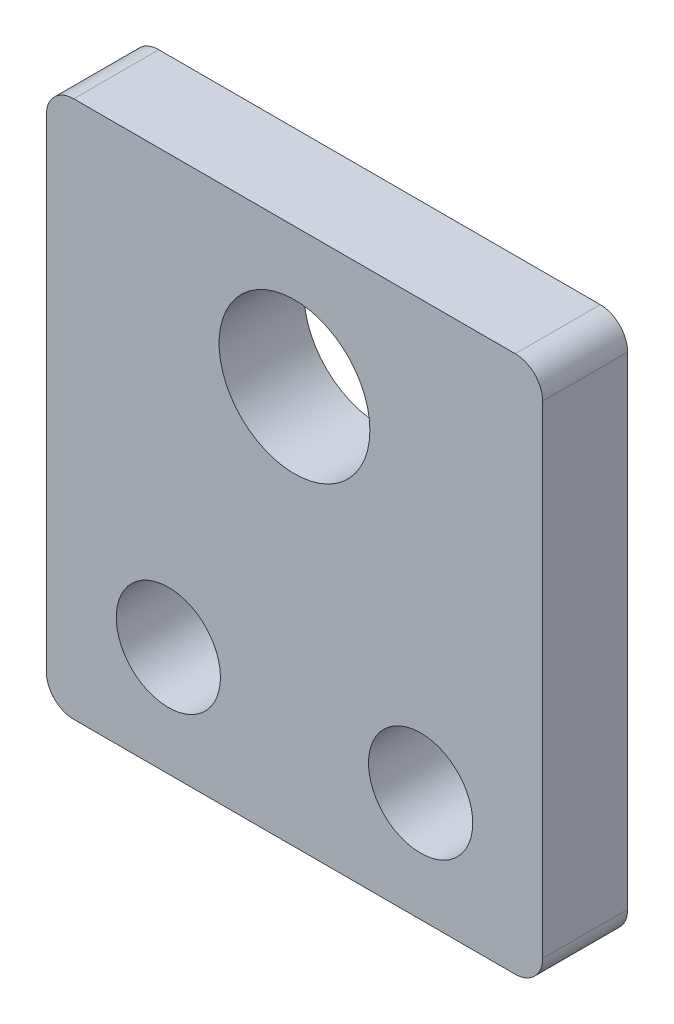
SolidWorks part; units mm, degrees
ref_plane "Front Plane" through (0, 0, 0) normal (0, 0, 1) x (1, 0, 0)
ref_plane "Top Plane" through (0, 0, 0) normal (0, 1, 0) x (1, 0, 0)
ref_plane "Right Plane" through (0, 0, 0) normal (1, 0, 0) x (0, 0, -1)
sketch "Sketch1" plane through (0, 0, 0) normal (0, 0, 1) x (1, 0, 0)
  line L1 (0, 0) -> (45.974, 0)
  line L2 (0, 0) -> (0, 49.784)
  line L3 (0, 49.784) -> (45.974, 49.784)
  line L4 (45.974, 0) -> (45.974, 49.784)
  dimension "D1" = 45.974
  dimension "D2" = 49.784
extrude "Boss-Extrude1" add sketch "Sketch1" along normal blind 7.874
sketch "Sketch2" plane through (0, 0, 7.874) normal (0, 0, 1) x (1, 0, 0)
  line L0 (0, 0) -> (11.303, 0) construction
  line L1 (0, 0) -> (45.974, 0) construction
  line L2 (11.303, 0) -> (11.303, 10.16) construction
  line L3 (45.974, 0) -> (34.671, 0) construction
  line L4 (34.671, 0) -> (34.671, 10.16) construction
  line L5 (22.987, 0) -> (22.987, 36.9062) construction
  circle A0 centre (34.671, 10.16) radius 4.826
  circle A1 centre (11.303, 10.16) radius 4.826
  circle A2 centre (22.987, 36.9062) radius 6.985
  dimension "D6" = 13.97
  dimension "D7" = 9.652
  dimension "D8" = 9.652
  dimension "D1" = 11.303
  dimension "D2" = 11.303
  dimension "D3" = 10.16
  dimension "D4" = 10.16
  dimension "D5" = 36.9062
extrude "Cut-Extrude1" cut sketch "Sketch2" against normal through all contours A2 | A0 | A1
fillet "Fillet1" radius 2.54 4 edges at (45.974, 0, 3.937) (0, 0, 3.937) (0, 49.784, 3.937) (45.974, 49.784, 3.937)
